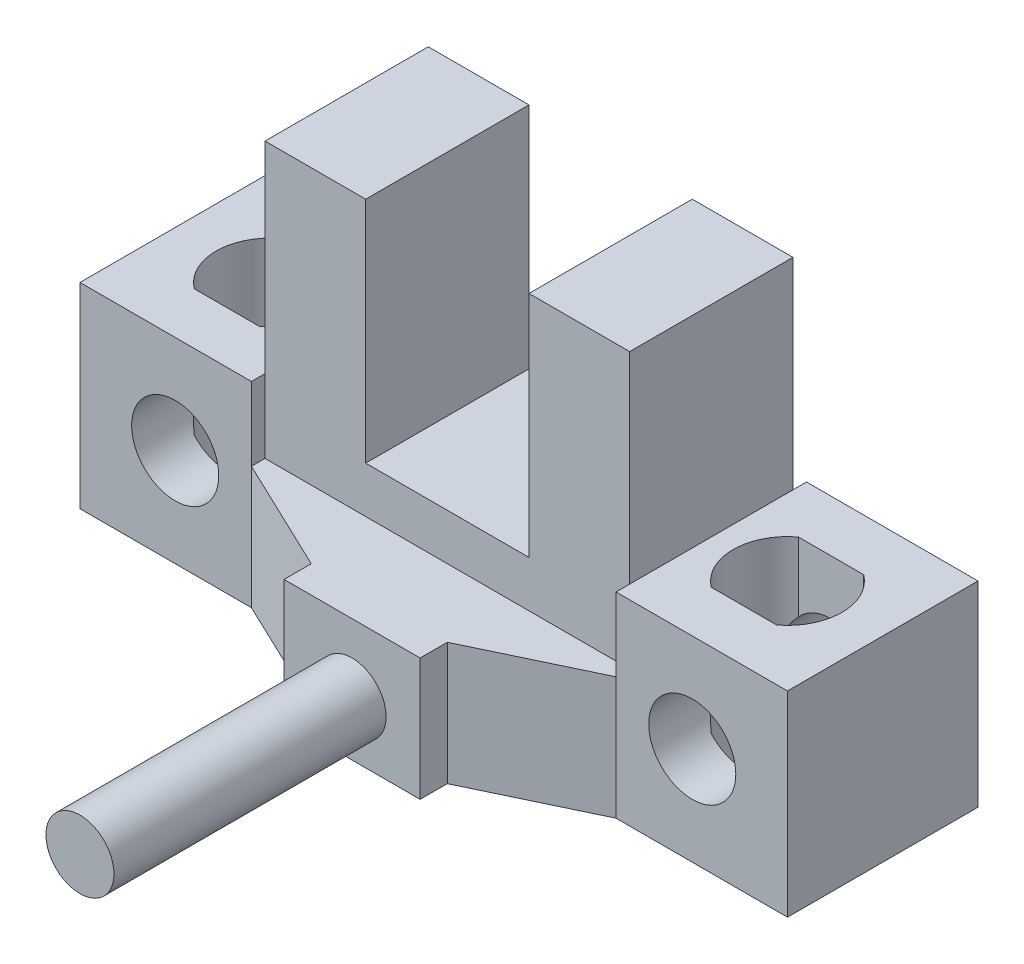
SolidWorks part; units mm, degrees
ref_plane "前视基准面" through (0, 0, 0) normal (0, 0, 1) x (1, 0, 0)
ref_plane "上视基准面" through (0, 0, 0) normal (0, 1, 0) x (1, 0, 0)
ref_plane "右视基准面" through (0, 0, 0) normal (1, 0, 0) x (0, 0, -1)
sketch "草图1" plane through (0, 0, 0) normal (0, 0, 1) x (1, 0, 0)
  line L0 (0, 0) -> (0, 7.2)
  line L1 (0, 7.2) -> (6.3, 7.2)
  line L2 (6.3, 7.2) -> (6.3, 14.6)
  line L3 (6.3, 14.6) -> (10, 14.6)
  line L4 (10, 14.6) -> (10, 6.2)
  line L5 (10, 6.2) -> (16, 6.2)
  line L6 (16, 6.2) -> (16, 14.6)
  line L7 (16, 14.6) -> (19.7, 14.6)
  line L8 (19.7, 14.6) -> (19.7, 7.2)
  line L9 (19.7, 7.2) -> (26, 7.2)
  line L10 (26, 7.2) -> (26, 0)
  line L11 (0, 0) -> (26, 0)
extrude "凸台-拉伸1" add sketch "草图1" along normal blind 7
sketch "草图2" plane through (0, 0, 7) normal (0, 0, 1) x (1, 0, 0)
  line L0 (6.3, 7.2) -> (6.3, 14.6)
  line L1 (6.3, 14.6) -> (10, 14.6)
  line L2 (10, 14.6) -> (10, 6.2)
  line L3 (10, 6.2) -> (16, 6.2)
  line L4 (16, 6.2) -> (16, 14.6)
  line L5 (16, 14.6) -> (19.7, 14.6)
  line L6 (19.7, 14.6) -> (19.7, 0)
  line L7 (0, 0) -> (26, 0) construction
  line L8 (19.7, 0) -> (6.3, 0)
  line L9 (6.3, 0) -> (6.3, 7.2)
extrude "切除-拉伸1" cut sketch "草图2" against normal blind 0.5
sketch "草图3" plane through (0, 0, 0) normal (0, 0, -1) x (-1, 0, 0)
  line L0 (-19.7, 7.2) -> (-19.7, 14.6)
  line L1 (-19.7, 14.6) -> (-16, 14.6)
  line L2 (-16, 14.6) -> (-16, 6.2)
  line L3 (-16, 6.2) -> (-10, 6.2)
  line L4 (-10, 6.2) -> (-10, 14.6)
  line L5 (-10, 14.6) -> (-6.3, 14.6)
  line L6 (-6.3, 14.6) -> (-6.3, 0)
  line L7 (-6.3, 0) -> (-19.7, 0)
  line L8 (0, 0) -> (-26, 0) construction
  line L9 (-19.7, 0) -> (-19.7, 7.2)
extrude "切除-拉伸2" cut sketch "草图3" against normal blind 0.5 contours L9 L0 L1 L2 L3 L4 L5 L6 L7
sketch "草图4" plane through (0, 0, 0) normal (0, -1, 0) x (1, 0, 0)
  line L0 (6.3, 7) -> (6.3, 6.5)
  line L2 (6.3, 6.5) -> (19.7, 6.5)
  line L3 (19.7, 6.5) -> (19.7, 7)
  line L5 (19.7, 7) -> (15.5, 9)
  line L6 (15.5, 9) -> (15.5, 10)
  line L7 (15.5, 10) -> (10.5, 10)
  line L8 (10.5, 10) -> (10.5, 9)
  line L9 (6.3, 7) -> (10.5, 9)
extrude "凸台-拉伸3" add sketch "草图4" against normal blind 4.5 contours L7 L8 L9 L0 L2 L3 L5 L6
sketch "草图5" plane through (0, 0, 7) normal (0, 0, 1) x (1, 0, 0)
  circle A0 centre (3.5, 3.6) radius 1.6
extrude "切除-拉伸3" cut sketch "草图5" against normal blind 7
sketch "草图6" plane through (0, 0, 7) normal (0, 0, 1) x (1, 0, 0)
  circle A0 centre (22.5, 3.6) radius 1.6
extrude "切除-拉伸4" cut sketch "草图6" against normal blind 7
sketch "草图7" plane through (0, 7.2, 0) normal (0, 1, 0) x (1, 0, 0)
  line L5 (3.5, -1.9) -> (4.7, -1.9)
  line L7 (4.7, -5.1) -> (2.3, -5.1)
  line L9 (2.3, -1.9) -> (3.5, -1.9)
  arc A0 (2.3, -1.9) -> (2.3, -5.1) centre (3.5, -3.5) ccw
  arc A1 (4.7, -5.1) -> (4.7, -1.9) centre (3.5, -3.5) ccw
extrude "切除-拉伸6" cut sketch "草图7" against normal blind 7.2 contours A0 L7 A1 L5 L9
sketch "草图8" plane through (0, 7.2, 0) normal (0, 1, 0) x (1, 0, 0)
  line L2 (22.5, -1.9) -> (23.7, -1.9)
  line L4 (23.7, -5.1) -> (21.3, -5.1)
  line L6 (21.3, -1.9) -> (22.5, -1.9)
  arc A0 (23.7, -5.1) -> (23.7, -1.9) centre (22.5, -3.5) ccw
  arc A1 (21.3, -1.9) -> (21.3, -5.1) centre (22.5, -3.5) ccw
extrude "切除-拉伸7" cut sketch "草图8" against normal blind 7.2
sketch "草图9" plane through (0, 0, 10) normal (0, 0, 1) x (1, 0, 0)
  circle A0 centre (13, 2) radius 1.25
extrude "凸台-拉伸4" add sketch "草图9" along normal blind 10
